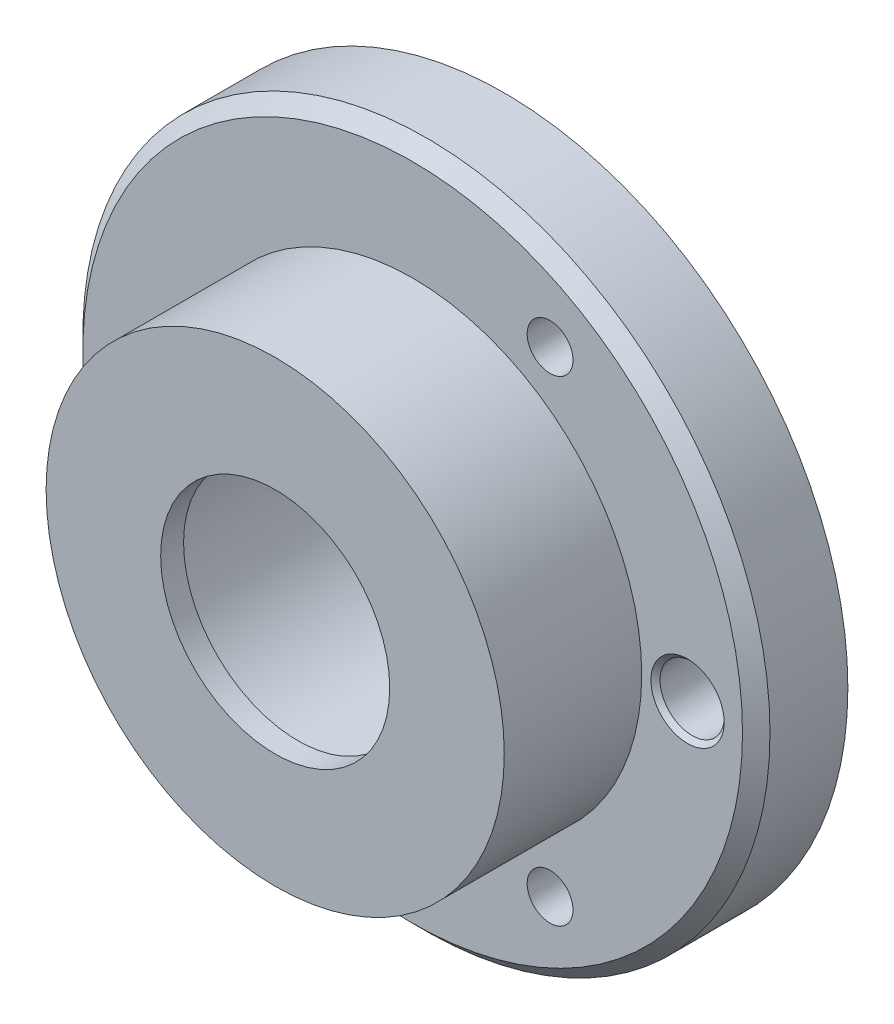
SolidWorks part; units mm, degrees
ref_plane "Ebene vorne" through (0, 0, 0) normal (0, 0, 1) x (1, 0, 0)
ref_plane "Ebene oben" through (0, 0, 0) normal (0, 1, 0) x (1, 0, 0)
ref_plane "Ebene rechts" through (0, 0, 0) normal (1, 0, 0) x (0, 0, -1)
sketch "Skizze1" plane through (0, 0, 0) normal (0, 0, 1) x (1, 0, 0)
  circle A0 centre (0, 0) radius 7.5
  dimension "D1" = 15
extrude "Linear austragen1" add sketch "Skizze1" along normal blind 2
sketch "Skizze2" plane through (0, 0, 2) normal (0, 0, 1) x (1, 0, 0)
  circle A0 centre (0, 0) radius 5
  dimension "D1" = 10
extrude "Linear austragen2" add sketch "Skizze2" along normal blind 3
sketch "Skizze3" plane through (0, 0, 5) normal (0, 0, 1) x (1, 0, 0)
  circle A0 centre (0, 0) radius 2.5
  dimension "D1" = 5
extrude "Schnitt-Linear austragen1" cut sketch "Skizze3" against normal up to next
sketch "Skizze4" plane through (0, 0, 0) normal (0, 0, -1) x (-1, 0, 0)
  circle A0 centre (0, 0) radius 3.05
  dimension "D1" = 6.1
extrude "Schnitt-Linear austragen2" cut sketch "Skizze4" against normal blind 4.5
sketch "Skizze6" plane through (0, 0, 0) normal (0, 0, -1) x (-1, 0, 0)
  line L0 (0, 0) -> (9.1029, 0) construction
  line L1 (0, 0) -> (-3, 5.1962) construction
  circle A0 centre (6, 0) radius 0.5
  circle A1 centre (-3, -5.1962) radius 0.5
  circle A2 centre (-3, 5.1962) radius 0.5
  dimension "D1" = 1
  dimension "D2" = 6
  dimension "D4" = 6
  dimension "D3" = 120
extrude "Schnitt-Linear austragen4" cut sketch "Skizze6" against normal through all
sketch "Skizze5" plane through (0, 0, 0) normal (0, 0, -1) x (-1, 0, 0)
  line L0 (-8.8491, 0) -> (0, 0) construction
  circle A0 centre (-6, 0) radius 0.7
  dimension "D1" = 1.4
  dimension "D2" = 6
extrude "Schnitt-Linear austragen3" cut sketch "Skizze5" against normal through all
chamfer "Fase1" distance 0.3 angle 45 1 edges at (7.5, 0, 2)
chamfer "Fase2" distance 0.3 angle 60 1 edges at (-3.05, 0, 0)
chamfer "Fase3" distance 0.1 angle 45 5 edges at (-6.5, 0, 0) (2.5, 5.1962, 0) (2.5, -5.1962, 0) (6.7, 0, 2) (5.3, 0, 0)
